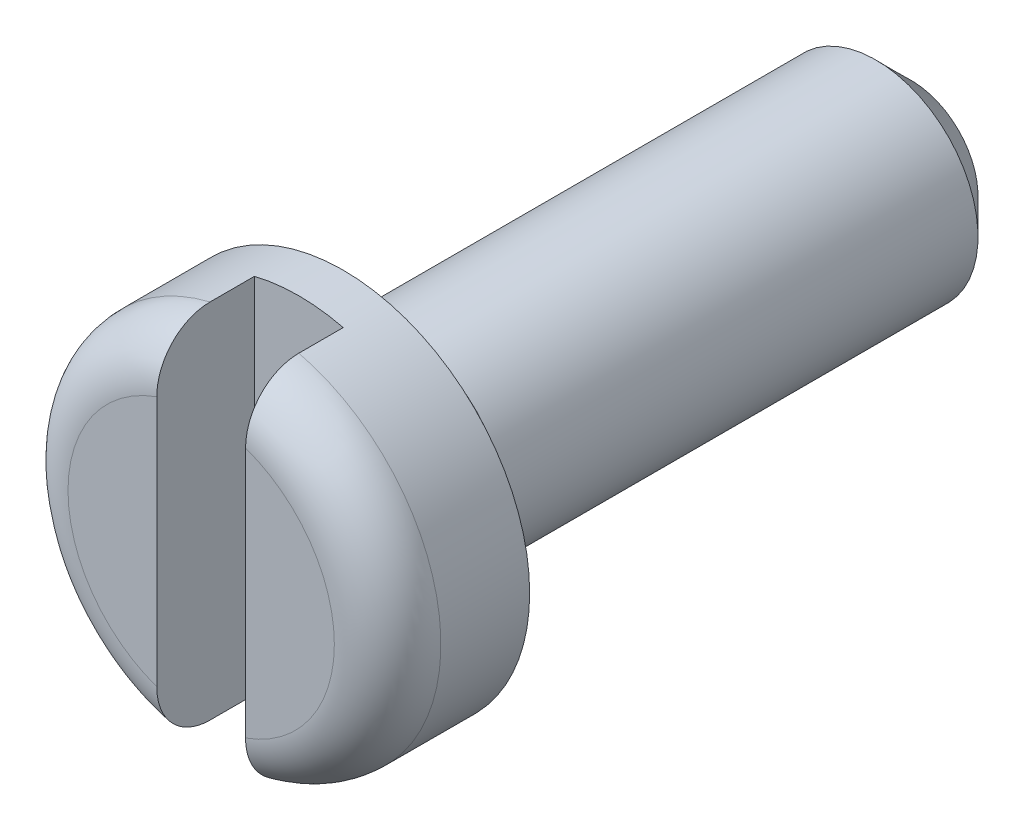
SolidWorks part; units mm, degrees
ref_plane "Face" through (0, 0, 0) normal (0, 0, 1) x (1, 0, 0)
ref_plane "Dessus" through (0, 0, 0) normal (0, 1, 0) x (1, 0, 0)
ref_plane "Droite" through (0, 0, 0) normal (1, 0, 0) x (0, 0, -1)
sketch "Esquisse1" plane through (0, 0, 0) normal (0, 0, 1) x (1, 0, 0)
  circle A0 centre (0, 0) radius 2.1
extrude "Base-Extrusion" add sketch "Esquisse1" along normal blind 1.6
fillet "Congé1" radius 0.6
sketch "Esquisse2" plane through (0, 0, 0) normal (0, 0, -1) x (-1, 0, 0)
  circle A0 centre (0, 0) radius 1.15
extrude "Boss.-Extru.1" add sketch "Esquisse2" along normal blind 6.4
chamfer "Chanfrein1" distance 0.4 angle 45
sketch "Esquisse3" plane through (0, 0, 0) normal (0, 1, 0) x (1, 0, 0)
  line L0 (0, -0.1018) -> (0, 6.3871) construction
  line L1 (-1.6277, 0) -> (2.954, 0) construction
  line L2 (2.3056, 0) -> (0.75, 0)
  line L3 (0.75, 6) -> (0.75, -2.0309) construction
  line L4 (0.75, 0) -> (0.75, 0.2113)
  line L5 (1.5043, 1.0854) -> (2.3056, 0)
  line L6 (0.75, 0.2113) -> (1.5043, 1.0854)
revolve "Enlèvement de matière-Révolution1" cut sketch "Esquisse3" angle 360 about L0
sketch "Esquisse4" plane through (0, 0, 0) normal (0, 1, 0) x (1, 0, 0)
  line L0 (0, -1.8227) -> (0, 6.2884) construction
  line L1 (-1.6716, 0) -> (4.083, 0) construction
  line L2 (-0.8056, -1.5815) -> (4.2803, -1.5815) construction
  line L3 (-0.9481, -0.5) -> (3.6445, -0.5) construction
  line L4 (0.5, -0.4197) -> (0.5, -1.7569) construction
  line L5 (-0.5, -0.321) -> (-0.5, -1.9761) construction
  line L7 (-0.5, -0.5) -> (0.5, -0.5)
  line L8 (-0.5, -0.5) -> (-0.5, -1.8227)
  line L9 (-0.5, -1.8227) -> (0.5, -1.8227)
  line L10 (0.5, -0.5) -> (0.5, -1.8227)
extrude "Enlèv. mat.-Extru.1" cut sketch "Esquisse4" against normal mid plane 6
